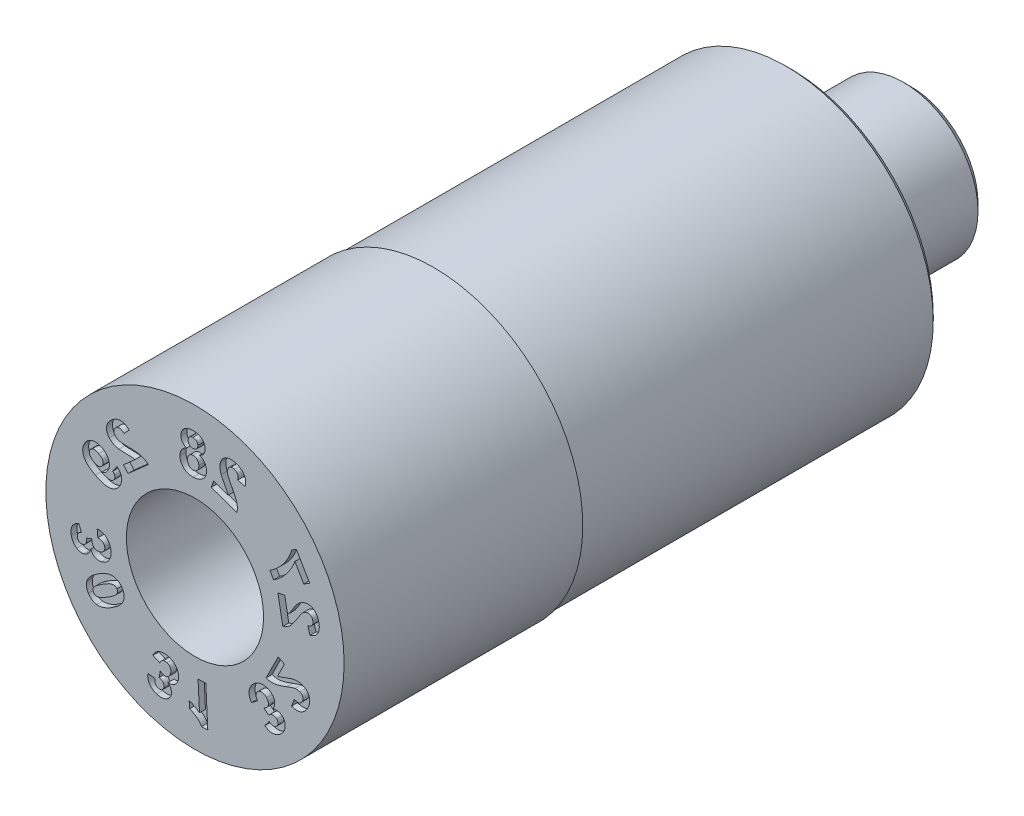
SolidWorks part; units mm, degrees
other "<M5 X .8 SHSS>-<Revolve1>"
ref_plane "Front Plane" through (0, 0, 0) normal (0, 0, 1) x (1, 0, 0)
ref_plane "Top Plane" through (0, 0, 0) normal (0, 1, 0) x (1, 0, 0)
ref_plane "Right Plane" through (0, 0, 0) normal (1, 0, 0) x (0, 0, -1)
sketch "Sketch1" plane through (0, 0, 0) normal (1, 0, 0) x (0, 0, -1)
  line L2 (0, 5) -> (0, 2.3)
  line L3 (19.75, 5) -> (0, 5)
  line L4 (-3.7979, 0) -> (49996.2021, 0) construction
  line L8 (16, 1.25) -> (4, 1.25)
  line L9 (4, 2.3) -> (4, 1.25)
  line L10 (4, 2.3) -> (0, 2.3)
  line L12 (20, 2.5) -> (20, 4.75)
  line L16 (20, 4.75) -> (19.75, 5)
  line L17 (20, 2.5) -> (16, 2.5)
  line L18 (16, 1.25) -> (16, 2.5)
  dimension "D1" = 20
  dimension "D2" = 45
  dimension "D3" = 0.25
  dimension "D4" = 10
  dimension "D5" = 4.6
  dimension "D6" = 4
  dimension "D7" = 2.5
  dimension "D8" = 5
  dimension "D9" = 4
revolve "Revolve1" add sketch "Sketch1" angle 360 about L4
sketch "Sketch4" plane through (0, 0, 0) normal (1, 0, 0) x (0, 0, -1)
  line L0 (0, 0) -> (50000, 0) construction
  line L1 (20, -4.75) -> (20, 4.75) construction
  line L2 (8, 5.935) -> (20, 5.935)
  line L3 (8, 5.935) -> (8, 4.935)
  line L4 (8, 4.935) -> (20, 4.935)
  line L5 (20, 5.935) -> (20, 4.935)
  line L6 (19.75, 5) -> (0, 5) construction
  line L9 (0, 5.5) -> (0, -5.5) construction
  dimension "D1" = 1
  dimension "D2" = 0.065
  dimension "D3" = 8
revolve "Cut-Revolve1" cut sketch "Sketch4" angle 360 about L0
sketch "Sketch2" plane through (0, 0, 0) normal (0, 0, 1) x (1, 0, 0)
  line L0 (0, 0) -> (0, 6.5633) construction
  line L1 (0, 0) -> (5.684, 3.2816) construction
  line L2 (0, 0) -> (5.684, -3.2816) construction
  line L3 (0, 0) -> (0, -6.5633) construction
  line L4 (0, 0) -> (-5.684, -3.2816) construction
  line L5 (0, 0) -> (-5.684, 3.2816) construction
  circle A0 centre (0, 0) radius 2.9521 construction
  text T0 "27  28  29  30  31  32" font "Arial" height 1.33
  point P11 (0, 0)
  point P1515 (0, 0.0075)
  point P1516 (0.0075, 0.0075)
  point P1517 (0.0075, 0)
  dimension "D1" = 6
extrude "Cut-Extrude1" cut sketch "Sketch2" against normal blind 0.2
sketch "Sketch3" plane through (0, 0, -4) normal (0, 0, 1) x (1, 0, 0)
  line L0 (0, 0) -> (0, 50000) construction
  line L1 (0.7217, 1.25) -> (-0.7217, 1.25)
  line L2 (-0.7217, 1.25) -> (-1.4434, 0)
  line L3 (-1.4434, 0) -> (-0.7217, -1.25)
  line L4 (-0.7217, -1.25) -> (0.7217, -1.25)
  line L5 (0.7217, -1.25) -> (1.4434, 0)
  line L6 (1.4434, 0) -> (0.7217, 1.25)
  line L7 (0, 0) -> (50000, 0) construction
  circle A0 centre (0, 0) radius 1.25 construction
  circle A1 centre (0, 0) radius 1.25 construction
extrude "Cut-Extrude2" cut sketch "Sketch3" against normal blind 2
inserted part "M5 X .8 SHSS"
move or copy body "Body-Move/Copy2" placed by mates yes
